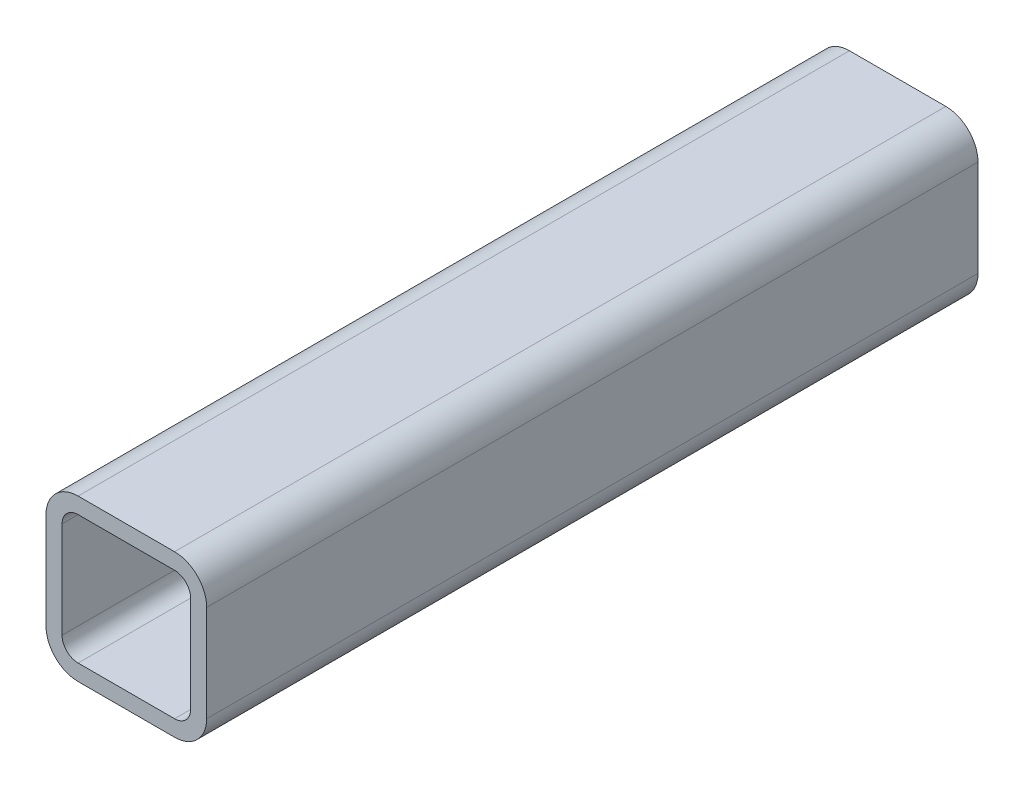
SolidWorks part; units mm, degrees
ref_plane "Front Plane" through (0, 0, 0) normal (0, 0, 1) x (1, 0, 0)
ref_plane "Top Plane" through (0, 0, 0) normal (0, 1, 0) x (1, 0, 0)
ref_plane "Right Plane" through (0, 0, 0) normal (1, 0, 0) x (0, 0, -1)
sketch "Sketch1" plane through (0, 0, 0) normal (0, 0, 1) x (1, 0, 0)
sketch_block_instance "HSS2.5x2.5x0.250-1"
sketch_block "HSS2.5x2.5x0.250"
extrude "Boss-Extrude1" add sketch "Sketch1" along normal blind 304.8
